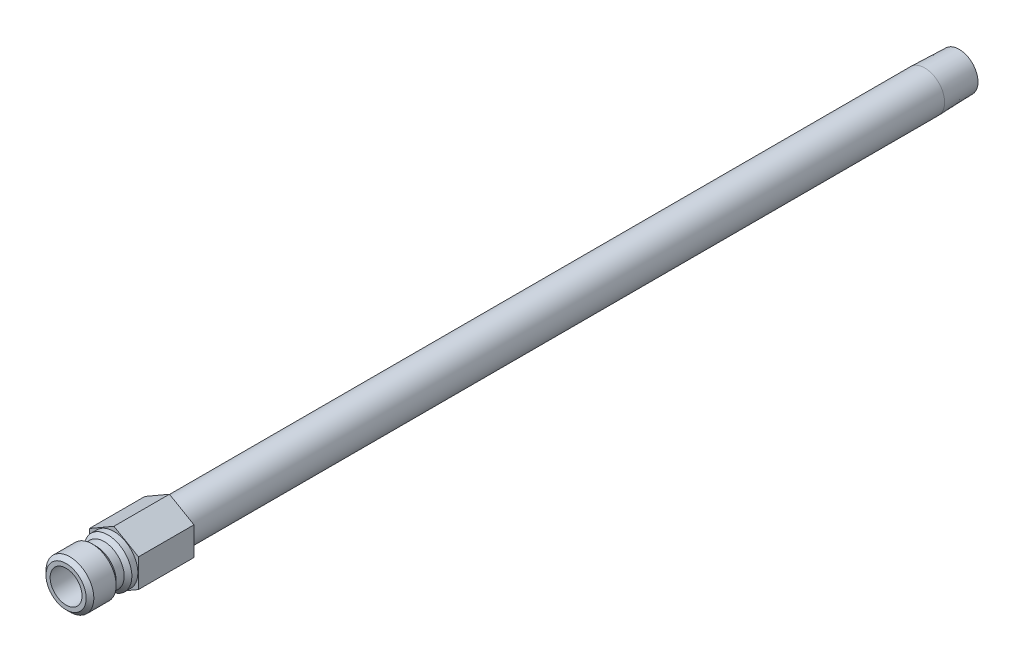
SolidWorks part; units mm, degrees
ref_plane "Front Plane" through (0, 0, 0) normal (0, 0, 1) x (1, 0, 0)
ref_plane "Top Plane" through (0, 0, 0) normal (0, 1, 0) x (1, 0, 0)
ref_plane "Right Plane" through (0, 0, 0) normal (1, 0, 0) x (0, 0, -1)
sketch "Sketch1" plane through (0, 0, 0) normal (1, 0, 0) x (0, 0, -1)
  line L0 (0, 0) -> (-12.7, 0) construction
  line L1 (-9.525, 3.175) -> (-9.525, 4.0005)
  line L2 (-3.556, 4.0005) -> (-3.556, 0) construction
  line L3 (-8.763, 4.7625) -> (-4.318, 4.7625)
  line L4 (0, 3.9688) -> (0, 3.175) construction
  line L5 (-3.556, 4.0005) -> (-1.9558, 4.0005)
  line L6 (-1.1938, 4.7625) -> (0, 4.7625)
  line L7 (0, 4.7625) -> (0, 3.9688)
  line L8 (-3.556, 4.0005) -> (-4.318, 4.7625)
  line L9 (-1.9558, 4.0005) -> (-1.1938, 4.7625)
  line L10 (-9.525, 4.0005) -> (-8.763, 4.7625)
  line L11 (0.127, 3.175) -> (0.127, 2.3813)
  line L12 (0, 3.9688) -> (161.417, 3.9688)
  line L13 (161.417, 3.9688) -> (168.275, 3.7544)
  line L14 (168.275, 3.7544) -> (168.275, 2.3813)
  line L15 (0, 0) -> (11.049, 0) construction
  line L16 (11.049, 0) -> (11.049, 4.7625) construction
  line L17 (11.049, 4.7625) -> (0, 4.7625) construction
  line L19 (0.127, 3.175) -> (-9.525, 3.175)
  line L20 (0.127, 2.3813) -> (168.275, 2.3813)
  line L21 (0, 2.6543) -> (0, 0) construction
  dimension "D1" = 9.525
  dimension "D2" = 1.6002
  dimension "D3" = 0.762
  dimension "D4" = 45
  dimension "D5" = 5.969
  dimension "D6" = 45
  dimension "D7" = 1.79
  dimension "D8" = 6.858
  dimension "D9" = 177.8
  dimension "D10" = 3.175
  dimension "D11" = 20.574
  dimension "D12" = 6.35
  dimension "D13" = 4.7625
  dimension "D14" = 9.525
  dimension "D15" = 7.9375
  dimension "D16" = 9.652
revolve "Revolve1" add sketch "Sketch1" angle 360 about L0
sketch "Sketch2" plane through (0, 0, 0) normal (0, 0, 1) x (1, 0, 0)
  line L1 (-4.8895, 2.823) -> (-4.8895, -2.823)
  line L2 (-4.8895, -2.823) -> (0, -5.6459)
  line L3 (0, -5.6459) -> (4.8895, -2.823)
  line L4 (4.8895, -2.823) -> (4.8895, 2.823)
  line L5 (4.8895, 2.823) -> (0, 5.6459)
  line L6 (0, 5.6459) -> (-4.8895, 2.823)
  circle A0 centre (0, 0) radius 4.8895 construction
  circle A1 centre (0, 0) radius 2.3812 construction
  circle A2 centre (0, 0) radius 2.3812
  dimension "D1" = 9.779
extrude "Boss-Extrude1" add sketch "Sketch2" against normal up to vertex (11.049 mm away) from vertex at 0
